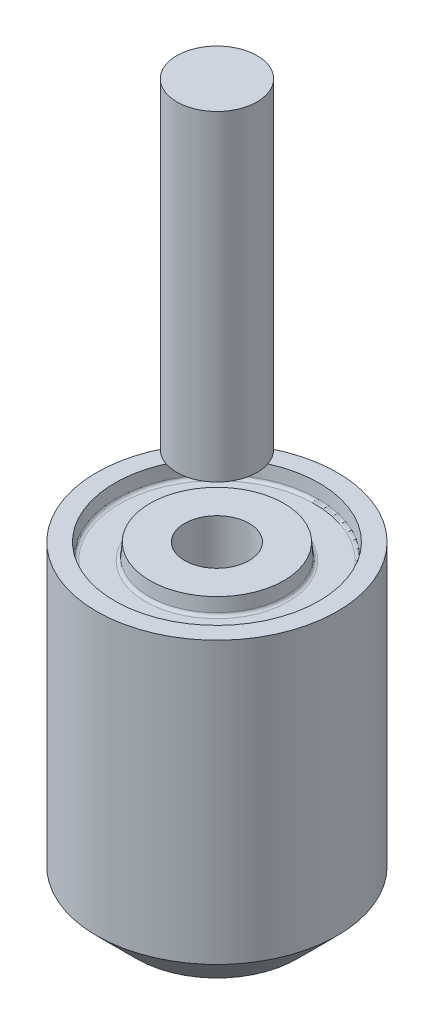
SolidWorks part; units mm, degrees
ref_plane "Front" through (0, 0, 0) normal (0, 0, 1) x (1, 0, 0)
ref_plane "Top" through (0, 0, 0) normal (0, 1, 0) x (1, 0, 0)
ref_plane "Right" through (0, 0, 0) normal (1, 0, 0) x (0, 0, -1)
sketch "Sketch1" plane through (0, 0, 0) normal (0, 1, 0) x (1, 0, 0)
  circle A0 centre (0, 0) radius 9.525
  dimension "D1" = 19.05
extrude "Extrude1" add sketch "Sketch1" against normal blind 25.4
sketch "Sketch2" plane through (0, 0, 0) normal (0, 1, 0) x (1, 0, 0)
  circle A0 centre (0, 0) radius 4.7625
  dimension "D1" = 9.525
chamfer "Chamfer1" distance 3.175 angle 45 1 edges at (0, -25.4, 9.525)
ref_plane "Plane1" through (0, 0, 0) normal (-1, 0, 0) x (0, 0, 1)
ref_plane "Plane2" through (0, 0, 0) normal (-1, 0, 0) x (0, 0, 1)
ref_plane "Plane3" through (0, 0, 0) normal (-1, 0, 0) x (0, 0, 1)
hole_wizard "1/4-20 Tapped Hole1" positions "Sketch14" profile "Sketch13" tap size "1/4-20" standard "Ansi Inch"
sketch "Sketch14" plane through (0, 0, 0) normal (0, 1, 0) x (-1, 0, 0)
  point P0 (0, 0)
sketch "Sketch13" plane through (0, 0, 0) normal (1, 0, 0) x (0, 0, 1)
  line L0 (0, 0) -> (0, 18.8566)
  line L1 (0, 18.8566) -> (2.5527, 17.3228)
  line L2 (2.5527, 17.3228) -> (2.5527, 0)
  line L5 (2.5527, 0) -> (0, 0)
  line L10 (0, 18.8566) -> (-2.5527, 17.3228) construction
  line L11 (0, -6.35) -> (0, 107.95) construction
  dimension "Tap Drill Dia." = 5.1054
  dimension "Tap Drill Depth" = 17.3228
  dimension "Drill Angle" = 118
sketch "Sketch9" plane through (0, 0, 0) normal (0, 0, 1) x (1, 0, 0)
  line L0 (5.3899, -1.0381) -> (5.2991, 0)
  line L1 (5.2991, 0) -> (8.0867, 0)
  line L2 (8.0867, 0) -> (7.9959, -1.0381)
  line L3 (7.7429, -1.27) -> (5.6429, -1.27)
  line L4 (0, 50) -> (0, -50) construction
  line L5 (5.3899, -1.0381) -> (5.4102, -1.27) construction
  line L6 (5.6429, -1.27) -> (5.4102, -1.27) construction
  line L7 (7.9959, -1.0381) -> (7.9756, -1.27) construction
  line L8 (7.7429, -1.27) -> (7.9756, -1.27) construction
  line L9 (9.525, 0) -> (-9.525, 0) construction
  arc A0 (7.9959, -1.0381) -> (7.7429, -1.27) centre (7.7429, -1.016) cw
  arc A1 (5.6429, -1.27) -> (5.3899, -1.0381) centre (5.6429, -1.016) cw
  dimension "D6" = 0.254
  dimension "D7" = 0.254
  dimension "D1" = 2.5654
  dimension "D2" = 1.27
  dimension "D3" = 95
  dimension "D4" = 10
  dimension "D5" = 10.8204
revolve "Groove for AS 568-013, O-Ring1" cut sketch "Sketch9"
sketch "Sketch15" plane through (0, 0, 0) normal (0, 1, 0) x (1, 0, 0)
  circle A0 centre (0, 0) radius 3.175
  dimension "D1" = 6.35
extrude "BrassStud#93025A961" add sketch "Sketch15" along normal blind 25.4 from offset 6.35 separate body
